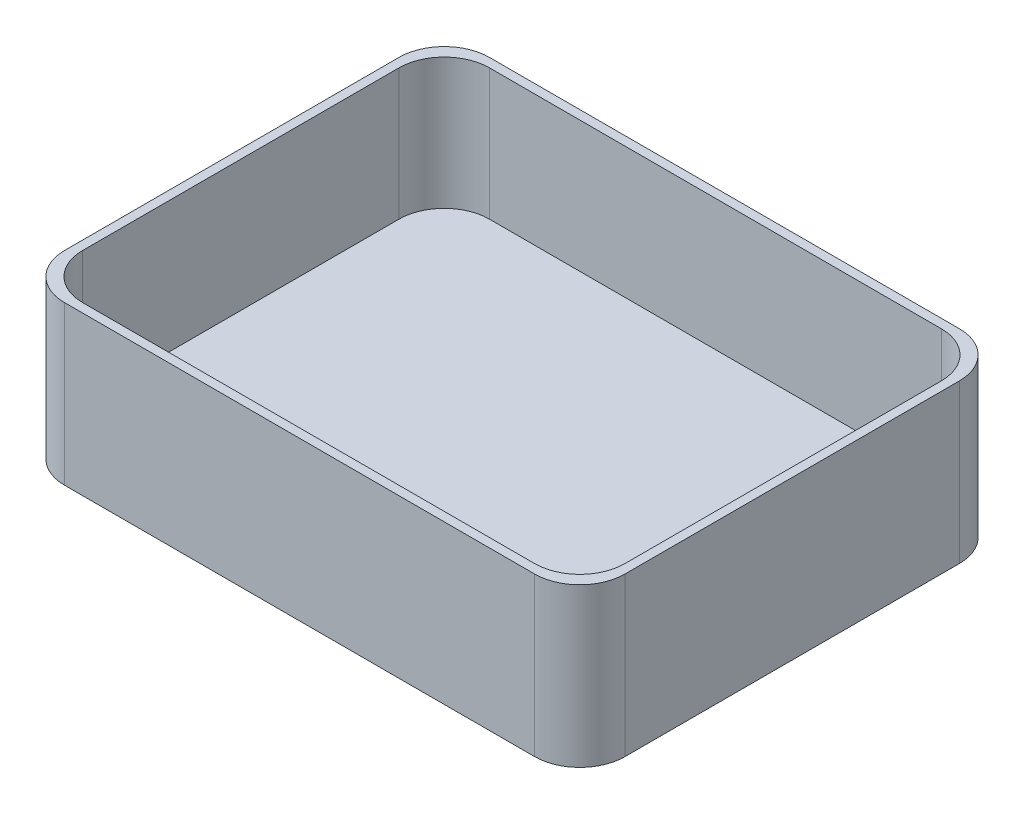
SolidWorks part; units mm, degrees
ref_plane "Front Plane" through (0, 0, 0) normal (0, 0, 1) x (1, 0, 0)
ref_plane "Top Plane" through (0, 0, 0) normal (0, 1, 0) x (1, 0, 0)
ref_plane "Right Plane" through (0, 0, 0) normal (1, 0, 0) x (0, 0, -1)
sketch "Sketch1" plane through (0, 0, 0) normal (0, 1, 0) x (1, 0, 0)
  line L1 (-62, 47) -> (62, 47)
  line L2 (-62, 47) -> (-62, -47)
  line L3 (-62, -47) -> (62, -47)
  line L4 (62, 47) -> (62, -47)
  line L5 (-62, 47) -> (62, -47) construction
  line L6 (-62, -47) -> (62, 47) construction
  point P0 (0, 0)
extrude "Boss-Extrude1" add sketch "Sketch1" along normal blind 35
sketch "Sketch2" plane through (0, 35, 0) normal (0, 1, 0) x (1, 0, 0)
  line L1 (-60, 45) -> (60, 45)
  line L2 (-60, 45) -> (-60, -45)
  line L3 (-60, -45) -> (60, -45)
  line L4 (60, 45) -> (60, -45)
  line L5 (-60, 45) -> (60, -45) construction
  line L6 (-60, -45) -> (60, 45) construction
  point P0 (0, 0)
extrude "Cut-Extrude1" cut sketch "Sketch2" against normal blind 29
fillet "Fillet1" radius 10 4 edges at (-60, 20.5, -45) (60, 20.5, -45) (-60, 20.5, 45) (60, 20.5, 45)
fillet "Fillet2" radius 10 4 edges at (62, 17.5, -47) (-62, 17.5, -47) (-62, 17.5, 47) (62, 17.5, 47)
